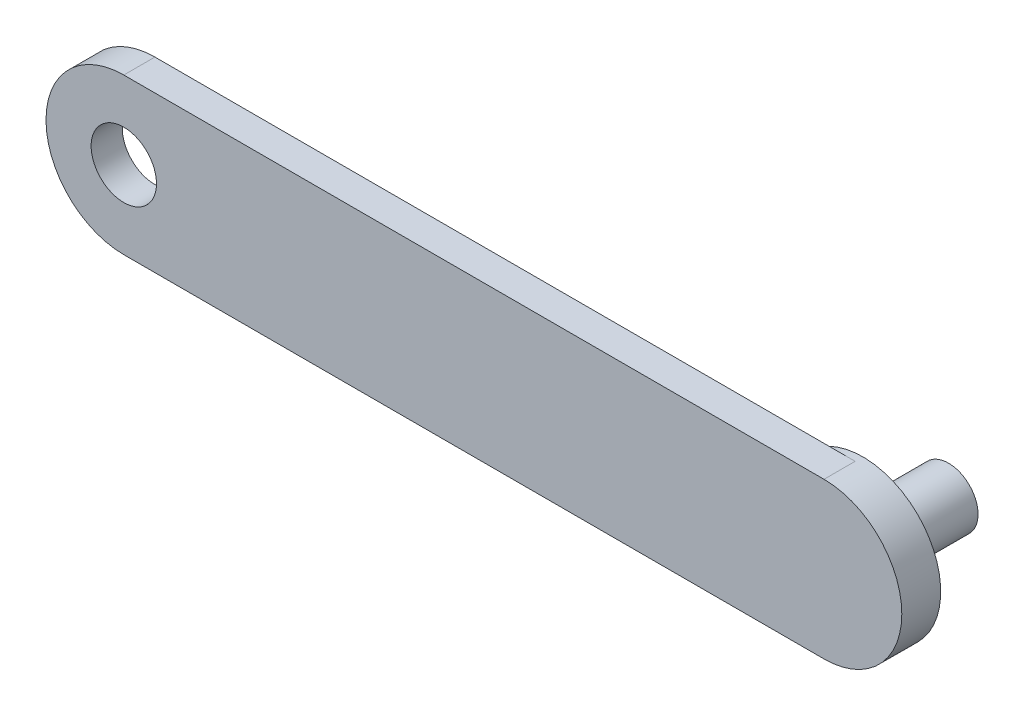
SolidWorks part; units mm, degrees
ref_plane "Plan de face" through (0, 0, 0) normal (0, 0, 1) x (1, 0, 0)
ref_plane "Plan de dessus" through (0, 0, 0) normal (0, 1, 0) x (1, 0, 0)
ref_plane "Plan de droite" through (0, 0, 0) normal (1, 0, 0) x (0, 0, -1)
sketch "Esquisse1" plane through (0, 0, 0) normal (0, 0, 1) x (1, 0, 0)
  line L0 (0, 0) -> (45, 0) construction
  line L1 (0, 5) -> (45, 5)
  line L2 (0, -5) -> (45, -5)
  arc A0 (0, 5) -> (0, -5) centre (0, 0) ccw
  arc A1 (45, -5) -> (45, 5) centre (45, 0) ccw
  circle A2 centre (0, 0) radius 2.1
  point P3 (22.5, 0)
  dimension "D1" = 4.2
  dimension "D2" = 45
  dimension "D3" = 10
extrude "Boss.-Extru.1" add sketch "Esquisse1" along normal blind 2
sketch "Esquisse2" plane through (0, 0, 0) normal (0, 0, -1) x (-1, 0, 0)
  circle A0 centre (-45, 0) radius 1.9
  dimension "D1" = 3.8
extrude "Boss.-Extru.2" add sketch "Esquisse2" along normal blind 6
sketch "Esquisse3" plane through (0, 0, 0) normal (0, 0, -1) x (-1, 0, 0)
  circle A0 centre (-45, 0) radius 5
  circle A1 centre (-45, 0) radius 1.9 construction
  circle A2 centre (-45, 0) radius 1.9
extrude "Boss.-Extru.3" add sketch "Esquisse3" along normal blind 0.5
